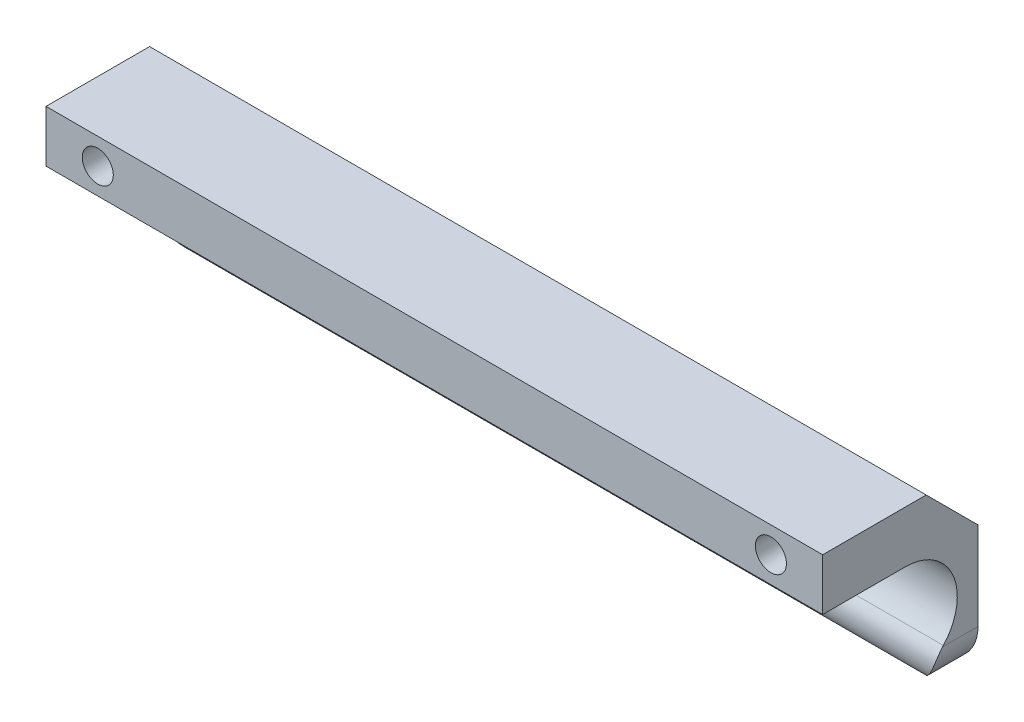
SolidWorks part; units mm, degrees
ref_plane "Front Plane" through (0, 0, 0) normal (0, 0, 1) x (1, 0, 0)
ref_plane "Top Plane" through (0, 0, 0) normal (0, 1, 0) x (1, 0, 0)
ref_plane "Right Plane" through (0, 0, 0) normal (1, 0, 0) x (0, 0, -1)
sketch "Sketch1" plane through (0, 0, 0) normal (1, 0, 0) x (0, 0, -1)
  line L1 (-15, -17.5) -> (15, -17.5)
  line L2 (-15, -17.5) -> (-15, 17.5)
  line L3 (-15, 17.5) -> (15, 17.5)
  line L4 (15, -17.5) -> (15, 17.5)
  line L5 (-15, -17.5) -> (15, 17.5) construction
  line L6 (-15, 17.5) -> (15, -17.5) construction
  point P0 (0, 0)
  dimension "D1" = 30
  dimension "D2" = 35
extrude "Extrude1" add sketch "Sketch1" along normal mid plane 150
chamfer "Chamfer1" distance 10 angle 45 1 edges at (0, 17.5, -15)
sketch "Sketch2" plane through (75, 0, 0) normal (1, 0, 0) x (0, 0, -1)
  line L0 (1, 7.5) -> (-15, 7.5)
  line L2 (-15, 17.5) -> (-15, -17.5) construction
  line L3 (5, 17.5) -> (-15, 17.5) construction
  line L4 (15, -17.5) -> (15, 7.5) construction
  line L7 (-15, -17.5) -> (15, -17.5) construction
  line L8 (15, -16.347) -> (15, -17.5)
  line L9 (15, -17.5) -> (-15, -17.5)
  line L10 (-15, -17.5) -> (-15, 7.5)
  arc A0 (8.3078, -9.3261) -> (15, -16.347) centre (11.8579, -12.6421) ccw
  arc A1 (8.3078, -9.3261) -> (1, 7.5) centre (1, -2.5) ccw
  point P3 (11, -2.5)
  point P16 (7, -12.6421)
  point P18 (11.8579, -17.5)
  dimension "D3" = 10
  dimension "D1" = 10
  dimension "D2" = 4
  dimension "D4" = 8
extrude "Extrude2" cut sketch "Sketch2" against normal blind 150 contours A0 A1 L0 M4 M5 | A0 L9 M1
sketch "Sketch3" plane through (0, 0, -15) normal (0, 0, -1) x (-1, 0, 0)
  line L0 (-75, -17.5) -> (-75, -9.5)
  line L1 (-75, -16.347) -> (-75, 7.5) construction
  line L2 (-75, -17.5) -> (75, -17.5) construction
  line L3 (-67, -17.5) -> (-75, -17.5)
  line L4 (75, -17.5) -> (75, -9.5)
  line L5 (75, -16.347) -> (75, 7.5) construction
  line L6 (75, -17.5) -> (67, -17.5)
  arc A0 (-75, -9.5) -> (-67, -17.5) centre (-67, -9.5) ccw
  arc A1 (67, -17.5) -> (75, -9.5) centre (67, -9.5) ccw
  dimension "D1" = 8
extrude "Extrude3" cut sketch "Sketch3" against normal through all
hole_wizard "M6x1.0 Tapped Hole1" positions "Sketch5" profile "Sketch4" tap size "M6x1.0" standard "Ansi Metric"
sketch "Sketch5" plane through (0, 0, 15) normal (0, 0, 1) x (1, 0, 0)
  line L0 (-75, 17.5) -> (-75, 7.5) construction
  line L1 (75, 17.5) -> (-75, 17.5) construction
  point P0 (-65, 12.5)
  point P2 (-75, 12.5)
  dimension "D1" = 10
  dimension "D2" = 5
sketch "Sketch4" plane through (-65, 12.5, 15) normal (1, 0, 0) x (0, -1, 0)
  line L0 (0, 0) -> (0, 18.5022)
  line L1 (0, 18.5022) -> (2.5, 17)
  line L2 (2.5, 17) -> (2.5, 12)
  line L3 (2.5, 12) -> (3, 12)
  line L4 (3, 12) -> (3, 0)
  line L5 (3, 0) -> (0, 0)
  line L10 (0, 18.5022) -> (-2.5, 17) construction
  line L11 (0, -6.35) -> (0, 107.95) construction
  dimension "Tap Drill Dia." = 5
  dimension "Tap Drill Depth" = 17
  dimension "Thread Major Dia." = 6
  dimension "Thread Depth" = 12
  dimension "Drill Angle" = 118
mirror "Mirror1" about plane through (0, 0, 0) normal (1, 0, 0) of "M6x1.0 Tapped Hole1"
